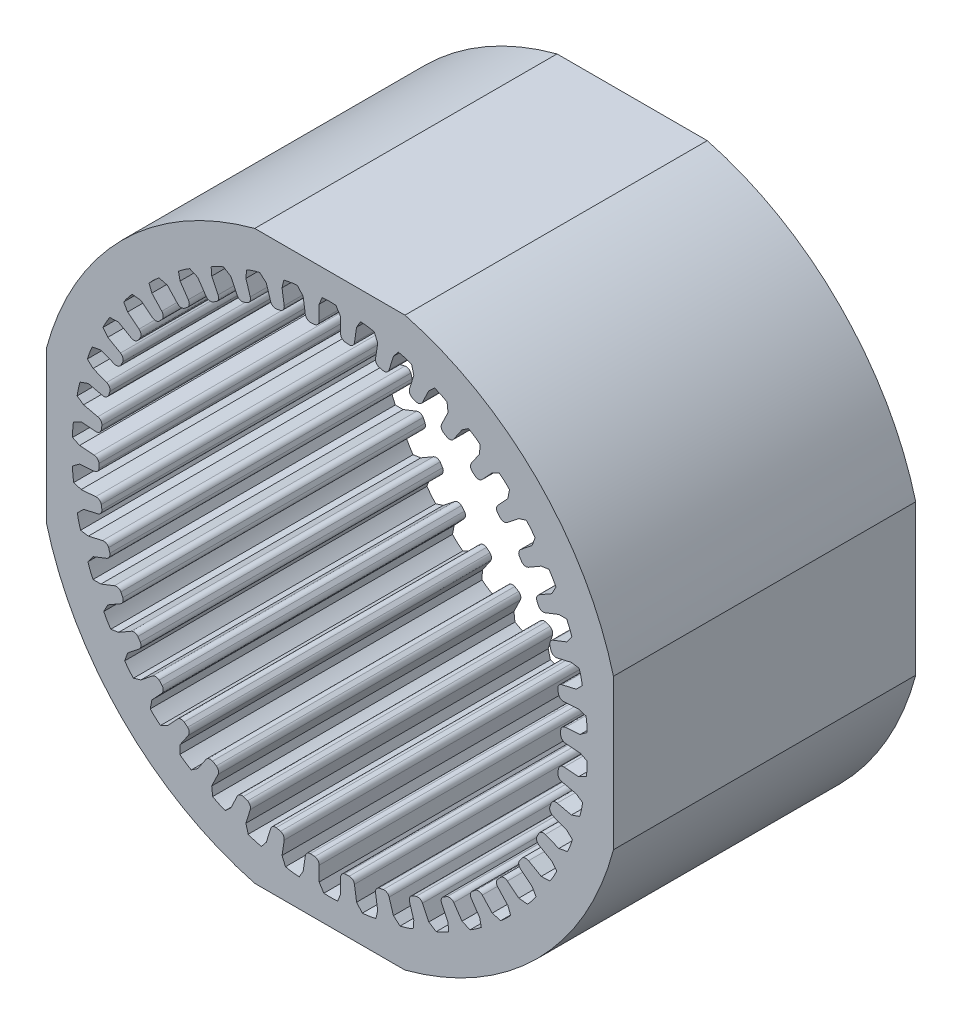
SolidWorks part; units mm, degrees
ref_plane "Plan de face" through (0, 0, 0) normal (0, 0, 1) x (1, 0, 0)
ref_plane "Plan de dessus" through (0, 0, 0) normal (0, 1, 0) x (1, 0, 0)
ref_plane "Plan de droite" through (0, 0, 0) normal (1, 0, 0) x (0, 0, -1)
sketch "Esquisse2" plane through (0, 0, 0) normal (0, 0, 1) x (1, 0, 0)
  line L0 (-28.1926, 15.95) -> (-15.95, 15.95)
  line L1 (-15.95, 18.2904) -> (-15.95, 15.95)
  line L2 (0, 0) -> (0, 12.7931) construction
  line L3 (0, 0) -> (11.1029, 0) construction
  line L5 (15.95, 4.2246) -> (15.95, -4.2246)
  line L6 (-4.2246, 15.95) -> (4.2246, 15.95)
  line L8 (-15.95, 4.2246) -> (-15.95, -4.2246)
  line L9 (-4.2246, -15.95) -> (4.2246, -15.95)
  arc A0 (-4.2246, 15.95) -> (-15.95, 4.2246) centre (0, 0) ccw
  arc A1 (-15.95, -4.2246) -> (-4.2246, -15.95) centre (0, 0) ccw
  arc A2 (4.2246, -15.95) -> (15.95, -4.2246) centre (0, 0) ccw
  arc A3 (15.95, 4.2246) -> (4.2246, 15.95) centre (0, 0) ccw
  dimension "D1" = 33
  dimension "D2" = 15.95
  dimension "D3" = 15.95
extrude "Extrusion1" add sketch "Esquisse2" along normal blind 17 contours L5 A3 L6 A0 L8 A1 L9 A2
sketch "Esquisse3" plane through (0, 0, 17) normal (0, 0, 1) x (1, 0, 0)
  line L0 (-0.4376, 14.4796) -> (-0.6, 14.071)
  line L1 (-0.6, 14.071) -> (-0.6, 13.25)
  line L2 (0.6, 14.0711) -> (0.6, 13.2527)
  line L3 (0.3385, 14.4878) -> (0.6, 14.0711)
  line L4 (0, 0) -> (0, 17.4119) construction
  line L5 (0, 14.5) -> (0, -4.5486) construction
  line L6 (1.7254, 14.3831) -> (1.5039, 14.0033)
  line L7 (1.5039, 14.0033) -> (1.3815, 13.1914)
  line L8 (2.6905, 13.8245) -> (2.5685, 13.0152)
  line L9 (2.494, 14.2755) -> (2.6905, 13.8245)
  line L10 (3.8498, 13.9653) -> (3.5742, 13.6228)
  line L11 (3.5742, 13.6228) -> (3.3322, 12.8382)
  line L12 (4.7209, 13.2691) -> (4.4796, 12.4871)
  line L13 (4.5938, 13.7444) -> (4.7209, 13.2691)
  line L14 (5.8882, 13.2355) -> (5.5646, 12.9379)
  line L15 (5.5646, 12.9379) -> (5.2084, 12.1982)
  line L16 (6.6458, 12.4173) -> (6.2907, 11.6799)
  line L17 (6.591, 12.9062) -> (6.6458, 12.4173)
  line L18 (7.7951, 12.2101) -> (7.4308, 11.964)
  line L19 (7.4308, 11.964) -> (6.9682, 11.2857)
  line L20 (8.4223, 11.2881) -> (7.9612, 10.6119)
  line L21 (8.4409, 11.7797) -> (8.4223, 11.2881)
  line L22 (9.5279, 10.9119) -> (9.1309, 10.7229)
  line L23 (9.1309, 10.7229) -> (8.5725, 10.121)
  line L24 (10.0106, 9.9067) -> (9.4539, 9.3068)
  line L25 (10.1023, 10.3901) -> (10.0106, 9.9067)
  line L26 (11.0478, 9.37) -> (10.6271, 9.2422)
  line L27 (10.6271, 9.2422) -> (9.9852, 8.7303)
  line L28 (11.3753, 8.3041) -> (10.7355, 7.7938)
  line L29 (11.538, 8.7684) -> (11.3753, 8.3041)
  line L30 (12.3209, 7.6187) -> (11.8859, 7.5551)
  line L31 (11.8859, 7.5551) -> (11.1748, 7.1446)
  line L32 (12.4859, 6.5159) -> (11.7772, 6.1067)
  line L33 (12.716, 6.9508) -> (12.4859, 6.5159)
  line L34 (13.3188, 5.6973) -> (12.8792, 5.6993)
  line L35 (12.8792, 5.6993) -> (12.1149, 5.3993)
  line L36 (13.3176, 4.5822) -> (12.5558, 4.2832)
  line L37 (13.61, 4.9779) -> (13.3176, 4.5822)
  line L38 (14.0192, 3.6486) -> (13.5847, 3.7161)
  line L39 (13.5847, 3.7161) -> (12.7843, 3.5334)
  line L40 (13.8518, 2.5461) -> (13.0539, 2.364)
  line L41 (14.1999, 2.8939) -> (13.8518, 2.5461)
  line L42 (14.4064, 1.5184) -> (13.9869, 1.6499)
  line L43 (13.9869, 1.6499) -> (13.1681, 1.5885)
  line L44 (14.0765, 0.4532) -> (13.2605, 0.3921)
  line L45 (14.4726, 0.7451) -> (14.0765, 0.4532)
  line L46 (14.4718, -0.6457) -> (14.0765, -0.4532)
  line L47 (14.0765, -0.4532) -> (13.2578, -0.3919)
  line L48 (13.9869, -1.6499) -> (13.1708, -1.5887)
  line L49 (14.422, -1.4202) -> (13.9869, -1.6499)
  line L50 (14.2139, -2.7954) -> (13.8518, -2.5461)
  line L51 (13.8518, -2.5461) -> (13.0513, -2.3634)
  line L52 (13.5848, -3.7161) -> (12.7869, -3.534)
  line L53 (14.0492, -3.5538) -> (13.5848, -3.7161)
  line L54 (13.6385, -4.8827) -> (13.3176, -4.5822)
  line L55 (13.3176, -4.5822) -> (12.5533, -4.2822)
  line L56 (12.8792, -5.6993) -> (12.1174, -5.4003)
  line L57 (13.3627, -5.6081) -> (12.8792, -5.6993)
  line L58 (12.7585, -6.8609) -> (12.4859, -6.5159)
  line L59 (12.4859, -6.5159) -> (11.7748, -6.1054)
  line L60 (11.8859, -7.5551) -> (11.1772, -7.146)
  line L61 (12.3776, -7.537) -> (11.8859, -7.5551)
  line L62 (11.5934, -8.6858) -> (11.3753, -8.3041)
  line L63 (11.3753, -8.3041) -> (10.7334, -7.7921)
  line L64 (10.6271, -9.2423) -> (9.9873, -8.732)
  line L65 (11.116, -9.2976) -> (10.6271, -9.2423)
  line L66 (10.1694, -10.3167) -> (10.0106, -9.9067)
  line L67 (10.0106, -9.9067) -> (9.4521, -9.3048)
  line L68 (9.1309, -10.7229) -> (8.5743, -10.123)
  line L69 (9.6061, -10.8505) -> (9.1309, -10.7229)
  line L70 (8.5182, -11.7171) -> (8.4222, -11.288)
  line L71 (8.4222, -11.288) -> (7.9597, -10.6097)
  line L72 (7.4308, -11.964) -> (6.9698, -11.2879)
  line L73 (7.8816, -12.161) -> (7.4308, -11.964)
  line L74 (6.6767, -12.8558) -> (6.6458, -12.4172)
  line L75 (6.6458, -12.4172) -> (6.2895, -11.6775)
  line L76 (5.5646, -12.9379) -> (5.2095, -12.2006)
  line L77 (5.9811, -13.1999) -> (5.5646, -12.9379)
  line L78 (4.6861, -13.7073) -> (4.7209, -13.2691)
  line L79 (4.7209, -13.2691) -> (4.4788, -12.4845)
  line L80 (3.5742, -13.6228) -> (3.333, -12.8408)
  line L81 (3.9469, -13.9439) -> (3.5742, -13.6228)
  line L82 (2.5907, -14.2526) -> (2.6905, -13.8245)
  line L83 (2.6905, -13.8245) -> (2.5681, -13.0126)
  line L84 (1.5039, -14.0033) -> (1.3819, -13.1941)
  line L85 (1.8246, -14.3764) -> (1.5039, -14.0033)
  line L86 (0.4376, -14.4796) -> (0.6, -14.071)
  line L87 (0.6, -14.071) -> (0.6, -13.25)
  line L88 (-0.6, -14.0711) -> (-0.6, -13.2527)
  line L89 (-0.3385, -14.4878) -> (-0.6, -14.0711)
  line L90 (-1.7254, -14.3831) -> (-1.5039, -14.0033)
  line L91 (-1.5039, -14.0033) -> (-1.3815, -13.1914)
  line L92 (-2.6905, -13.8245) -> (-2.5685, -13.0152)
  line L93 (-2.494, -14.2755) -> (-2.6905, -13.8245)
  line L94 (-3.8498, -13.9653) -> (-3.5742, -13.6228)
  line L95 (-3.5742, -13.6228) -> (-3.3322, -12.8382)
  line L96 (-4.7209, -13.2691) -> (-4.4796, -12.4871)
  line L97 (-4.5938, -13.7444) -> (-4.7209, -13.2691)
  line L98 (-5.8882, -13.2355) -> (-5.5646, -12.9379)
  line L99 (-5.5646, -12.9379) -> (-5.2084, -12.1982)
  line L100 (-6.6458, -12.4173) -> (-6.2907, -11.6799)
  line L101 (-6.591, -12.9062) -> (-6.6458, -12.4173)
  line L102 (-7.7951, -12.2101) -> (-7.4308, -11.964)
  line L103 (-7.4308, -11.964) -> (-6.9682, -11.2857)
  line L104 (-8.4223, -11.2881) -> (-7.9612, -10.6119)
  line L105 (-8.4409, -11.7797) -> (-8.4223, -11.2881)
  line L106 (-9.5279, -10.9119) -> (-9.1309, -10.7229)
  line L107 (-9.1309, -10.7229) -> (-8.5725, -10.121)
  line L108 (-10.0106, -9.9067) -> (-9.4539, -9.3068)
  line L109 (-10.1023, -10.3901) -> (-10.0106, -9.9067)
  line L110 (-11.0478, -9.37) -> (-10.6271, -9.2422)
  line L111 (-10.6271, -9.2422) -> (-9.9852, -8.7303)
  line L112 (-11.3753, -8.3041) -> (-10.7355, -7.7938)
  line L113 (-11.538, -8.7684) -> (-11.3753, -8.3041)
  line L114 (-12.3209, -7.6187) -> (-11.8859, -7.5551)
  line L115 (-11.8859, -7.5551) -> (-11.1748, -7.1446)
  line L116 (-12.4859, -6.5159) -> (-11.7772, -6.1067)
  line L117 (-12.716, -6.9508) -> (-12.4859, -6.5159)
  line L118 (-13.3188, -5.6973) -> (-12.8792, -5.6993)
  line L119 (-12.8792, -5.6993) -> (-12.1149, -5.3993)
  line L120 (-13.3176, -4.5822) -> (-12.5558, -4.2832)
  line L121 (-13.61, -4.9779) -> (-13.3176, -4.5822)
  line L122 (-14.0192, -3.6486) -> (-13.5847, -3.7161)
  line L123 (-13.5847, -3.7161) -> (-12.7843, -3.5334)
  line L124 (-13.8518, -2.5461) -> (-13.0539, -2.364)
  line L125 (-14.1999, -2.8939) -> (-13.8518, -2.5461)
  line L126 (-14.4064, -1.5184) -> (-13.9869, -1.6499)
  line L127 (-13.9869, -1.6499) -> (-13.1681, -1.5885)
  line L128 (-14.0765, -0.4532) -> (-13.2605, -0.3921)
  line L129 (-14.4726, -0.7451) -> (-14.0765, -0.4532)
  line L130 (-14.4718, 0.6457) -> (-14.0765, 0.4532)
  line L131 (-14.0765, 0.4532) -> (-13.2578, 0.3919)
  line L132 (-13.9869, 1.6499) -> (-13.1708, 1.5887)
  line L133 (-14.422, 1.4202) -> (-13.9869, 1.6499)
  line L134 (-14.2139, 2.7954) -> (-13.8518, 2.5461)
  line L135 (-13.8518, 2.5461) -> (-13.0513, 2.3634)
  line L136 (-13.5848, 3.7161) -> (-12.7869, 3.534)
  line L137 (-14.0492, 3.5538) -> (-13.5848, 3.7161)
  line L138 (-13.6385, 4.8827) -> (-13.3176, 4.5822)
  line L139 (-13.3176, 4.5822) -> (-12.5533, 4.2822)
  line L140 (-12.8792, 5.6993) -> (-12.1174, 5.4003)
  line L141 (-13.3627, 5.6081) -> (-12.8792, 5.6993)
  line L142 (-12.7585, 6.8609) -> (-12.4859, 6.5159)
  line L143 (-12.4859, 6.5159) -> (-11.7748, 6.1054)
  line L144 (-11.8859, 7.5551) -> (-11.1772, 7.146)
  line L145 (-12.3776, 7.537) -> (-11.8859, 7.5551)
  line L146 (-11.5934, 8.6858) -> (-11.3753, 8.3041)
  line L147 (-11.3753, 8.3041) -> (-10.7334, 7.7921)
  line L148 (-10.6271, 9.2423) -> (-9.9873, 8.732)
  line L149 (-11.116, 9.2976) -> (-10.6271, 9.2423)
  line L150 (-10.1694, 10.3167) -> (-10.0106, 9.9067)
  line L151 (-10.0106, 9.9067) -> (-9.4521, 9.3048)
  line L152 (-9.1309, 10.7229) -> (-8.5743, 10.123)
  line L153 (-9.6061, 10.8505) -> (-9.1309, 10.7229)
  line L154 (-8.5182, 11.7171) -> (-8.4222, 11.288)
  line L155 (-8.4222, 11.288) -> (-7.9597, 10.6097)
  line L156 (-7.4308, 11.964) -> (-6.9698, 11.2879)
  line L157 (-7.8816, 12.161) -> (-7.4308, 11.964)
  line L158 (-6.6767, 12.8558) -> (-6.6458, 12.4172)
  line L159 (-6.6458, 12.4172) -> (-6.2895, 11.6775)
  line L160 (-5.5646, 12.9379) -> (-5.2095, 12.2006)
  line L161 (-5.9811, 13.1999) -> (-5.5646, 12.9379)
  line L162 (-4.6861, 13.7073) -> (-4.7209, 13.2691)
  line L163 (-4.7209, 13.2691) -> (-4.4788, 12.4845)
  line L164 (-3.5742, 13.6228) -> (-3.333, 12.8408)
  line L165 (-3.9469, 13.9439) -> (-3.5742, 13.6228)
  line L166 (-2.5907, 14.2526) -> (-2.6905, 13.8245)
  line L167 (-2.6905, 13.8245) -> (-2.5681, 13.0126)
  line L168 (-1.5039, 14.0033) -> (-1.3819, 13.1941)
  line L169 (-1.8246, 14.3764) -> (-1.5039, 14.0033)
  line L170 (0.8462, 12.9578) -> (1.0982, 12.9364)
  line L171 (2.768, 12.6869) -> (3.014, 12.6283)
  line L172 (4.628, 12.1327) -> (4.8625, 12.038)
  line L173 (6.3846, 11.3074) -> (6.6023, 11.1789)
  line L174 (7.9985, 10.2295) -> (8.1947, 10.07)
  line L175 (9.4338, 8.9232) -> (9.604, 8.7361)
  line L176 (10.6584, 7.4175) -> (10.7988, 7.2072)
  line L177 (11.6448, 5.7461) -> (11.7524, 5.5172)
  line L178 (12.3712, 3.9463) -> (12.4434, 3.704)
  line L179 (12.8212, 2.0584) -> (12.8565, 1.808)
  line L180 (12.9848, 0.1245) -> (12.9823, -0.1284)
  line L181 (12.8583, -1.8122) -> (12.8182, -2.0618)
  line L182 (12.4446, -3.7083) -> (12.3677, -3.9493)
  line L183 (11.7529, -5.5217) -> (11.641, -5.7485)
  line L184 (10.7987, -7.2117) -> (10.6542, -7.4193)
  line L185 (9.6032, -8.7406) -> (9.4294, -8.9243)
  line L186 (8.1932, -10.0743) -> (7.994, -10.23)
  line L187 (6.6002, -11.1829) -> (6.38, -11.3072)
  line L188 (4.8598, -12.0417) -> (4.6235, -12.1318)
  line L189 (3.0108, -12.6315) -> (2.7637, -12.6854)
  line L190 (1.0945, -12.9391) -> (0.8422, -12.9556)
  line L191 (-0.8462, -12.9578) -> (-1.0982, -12.9364)
  line L192 (-2.768, -12.6869) -> (-3.014, -12.6283)
  line L193 (-4.628, -12.1327) -> (-4.8625, -12.038)
  line L194 (-6.3846, -11.3074) -> (-6.6023, -11.1789)
  line L195 (-7.9985, -10.2295) -> (-8.1947, -10.07)
  line L196 (-9.4338, -8.9232) -> (-9.604, -8.7361)
  line L197 (-10.6584, -7.4175) -> (-10.7988, -7.2072)
  line L198 (-11.6448, -5.7461) -> (-11.7524, -5.5172)
  line L199 (-12.3712, -3.9463) -> (-12.4434, -3.704)
  line L200 (-12.8212, -2.0584) -> (-12.8565, -1.808)
  line L201 (-12.9848, -0.1245) -> (-12.9823, 0.1284)
  line L202 (-12.8583, 1.8122) -> (-12.8182, 2.0618)
  line L203 (-12.4446, 3.7083) -> (-12.3677, 3.9493)
  line L204 (-11.7529, 5.5217) -> (-11.641, 5.7485)
  line L205 (-10.7987, 7.2117) -> (-10.6542, 7.4193)
  line L206 (-9.6032, 8.7406) -> (-9.4294, 8.9243)
  line L207 (-8.1932, 10.0743) -> (-7.994, 10.23)
  line L208 (-6.6002, 11.1829) -> (-6.38, 11.3072)
  line L209 (-4.8598, 12.0417) -> (-4.6235, 12.1318)
  line L210 (-3.0108, 12.6315) -> (-2.7637, 12.6854)
  line L211 (-1.0945, 12.9391) -> (-0.8422, 12.9556)
  arc A0 (1.3815, 13.1914) -> (1.0982, 12.9364) centre (1.0849, 13.2361) cw
  arc A1 (-0.6, 13.25) -> (-0.8422, 12.9556) centre (-0.9, 13.25) cw
  arc A2 (0.6, 13.2527) -> (0.8462, 12.9578) centre (0.9, 13.2529) ccw
  arc A3 (2.5685, 13.0152) -> (2.768, 12.6869) centre (2.8652, 12.9707) ccw
  arc A4 (2.494, 14.2755) -> (1.7254, 14.3831) centre (1.4606, 9.6905) ccw
  arc A5 (3.3322, 12.8382) -> (3.014, 12.6283) centre (3.0455, 12.9266) cw
  arc A6 (0.3385, 14.4878) -> (-0.4376, 14.4796) centre (0, 9.8) ccw
  arc A7 (4.4796, 12.4871) -> (4.628, 12.1327) centre (4.7664, 12.3988) ccw
  arc A8 (4.5938, 13.7444) -> (3.8498, 13.9653) centre (2.8886, 9.3646) ccw
  arc A9 (5.2084, 12.1982) -> (4.8625, 12.038) centre (4.9381, 12.3283) cw
  arc A10 (6.2907, 11.6799) -> (6.3846, 11.3074) centre (6.5611, 11.5499) ccw
  arc A11 (6.591, 12.9062) -> (5.8882, 13.2355) centre (4.2521, 8.8295) ccw
  arc A12 (6.9682, 11.2857) -> (6.6023, 11.1789) centre (6.7204, 11.4547) cw
  arc A13 (7.9612, 10.6119) -> (7.9985, 10.2295) centre (8.2092, 10.4431) ccw
  arc A14 (8.4409, 11.7797) -> (7.7951, 12.2101) centre (5.5205, 8.0971) ccw
  arc A15 (8.5725, 10.121) -> (8.1947, 10.07) centre (8.3525, 10.3251) cw
  arc A16 (9.4539, 9.3068) -> (9.4338, 8.9232) centre (9.674, 9.1029) ccw
  arc A17 (10.1023, 10.3901) -> (9.5279, 10.9119) centre (6.6657, 7.1839) ccw
  arc A18 (9.9852, 8.7303) -> (9.604, 8.7361) centre (9.7981, 8.9649) cw
  arc A19 (10.7355, 7.7938) -> (10.6584, 7.4175) centre (10.9227, 7.5594) ccw
  arc A20 (11.538, 8.7684) -> (11.0478, 9.37) centre (7.6619, 6.1102) ccw
  arc A21 (11.1748, 7.1446) -> (10.7988, 7.2072) centre (11.0248, 7.4044) cw
  arc A22 (11.7772, 6.1067) -> (11.6448, 5.7461) centre (11.9273, 5.847) ccw
  arc A23 (12.716, 6.9508) -> (12.3209, 7.6187) centre (8.487, 4.9) ccw
  arc A24 (12.1149, 5.3993) -> (11.7524, 5.5172) centre (12.0053, 5.6786) cw
  arc A25 (12.5558, 4.2832) -> (12.3712, 3.9463) centre (12.6656, 4.004) ccw
  arc A26 (13.61, 4.9779) -> (13.3188, 5.6973) centre (9.1226, 3.5803) ccw
  arc A27 (12.7843, 3.5334) -> (12.4434, 3.704) centre (12.7175, 3.8258) cw
  arc A28 (13.0539, 2.364) -> (12.8212, 2.0584) centre (13.1209, 2.0716) ccw
  arc A29 (14.1999, 2.8939) -> (14.0192, 3.6486) centre (9.5543, 2.1807) ccw
  arc A30 (13.1681, 1.5885) -> (12.8565, 1.808) centre (13.1457, 1.8877) cw
  arc A31 (13.2605, 0.3921) -> (12.9848, 0.1245) centre (13.2831, 0.0929) ccw
  arc A32 (14.4726, 0.7451) -> (14.4064, 1.5184) centre (9.7726, 0.7324) ccw
  arc A33 (13.2578, -0.3919) -> (12.9823, -0.1284) centre (13.2802, -0.0927) cw
  arc A34 (13.1708, -1.5887) -> (12.8583, -1.8122) centre (13.1486, -1.8879) ccw
  arc A35 (14.422, -1.4202) -> (14.4718, -0.6457) centre (9.7726, -0.7324) ccw
  arc A36 (13.0513, -2.3634) -> (12.8182, -2.0618) centre (13.1181, -2.071) cw
  arc A37 (12.7869, -3.534) -> (12.4446, -3.7083) centre (12.7203, -3.8265) ccw
  arc A38 (14.0492, -3.5538) -> (14.2139, -2.7954) centre (9.5543, -2.1807) ccw
  arc A39 (12.5533, -4.2822) -> (12.3677, -3.9493) centre (12.6629, -4.003) cw
  arc A40 (12.1174, -5.4003) -> (11.7529, -5.5217) centre (12.008, -5.6796) ccw
  arc A41 (13.3627, -5.6081) -> (13.6385, -4.8827) centre (9.1226, -3.5803) ccw
  arc A42 (11.7748, -6.1054) -> (11.641, -5.7485) centre (11.9248, -5.8456) cw
  arc A43 (11.1772, -7.146) -> (10.7987, -7.2117) centre (11.0273, -7.4059) ccw
  arc A44 (12.3776, -7.537) -> (12.7585, -6.8609) centre (8.487, -4.9) ccw
  arc A45 (10.7334, -7.7921) -> (10.6542, -7.4193) centre (10.9204, -7.5576) cw
  arc A46 (9.9873, -8.732) -> (9.6032, -8.7406) centre (9.8004, -8.9667) ccw
  arc A47 (11.116, -9.2976) -> (11.5934, -8.6858) centre (7.6619, -6.1102) ccw
  arc A48 (9.4521, -9.3048) -> (9.4294, -8.9243) centre (9.672, -9.1008) cw
  arc A49 (8.5743, -10.123) -> (8.1932, -10.0743) centre (8.3545, -10.3272) ccw
  arc A50 (9.6061, -10.8505) -> (10.1694, -10.3167) centre (6.6657, -7.1839) ccw
  arc A51 (7.9597, -10.6097) -> (7.994, -10.23) centre (8.2076, -10.4407) cw
  arc A52 (6.9698, -11.2879) -> (6.6002, -11.1829) centre (6.722, -11.457) ccw
  arc A53 (7.8816, -12.161) -> (8.5182, -11.7171) centre (5.5205, -8.0971) ccw
  arc A54 (6.2895, -11.6775) -> (6.38, -11.3072) centre (6.5598, -11.5473) cw
  arc A55 (5.2095, -12.2006) -> (4.8598, -12.0417) centre (4.9393, -12.3309) ccw
  arc A56 (5.9811, -13.1999) -> (6.6767, -12.8558) centre (4.2521, -8.8295) ccw
  arc A57 (4.4788, -12.4845) -> (4.6235, -12.1318) centre (4.7655, -12.3961) cw
  arc A58 (3.333, -12.8408) -> (3.0108, -12.6315) centre (3.0463, -12.9294) ccw
  arc A59 (3.9469, -13.9439) -> (4.6861, -13.7073) centre (2.8886, -9.3646) ccw
  arc A60 (2.5681, -13.0126) -> (2.7637, -12.6854) centre (2.8648, -12.9679) cw
  arc A61 (1.3819, -13.1941) -> (1.0945, -12.9391) centre (1.0853, -13.239) ccw
  arc A62 (1.8246, -14.3764) -> (2.5907, -14.2526) centre (1.4606, -9.6905) ccw
  arc A63 (0.6, -13.25) -> (0.8422, -12.9556) centre (0.9, -13.25) cw
  arc A64 (-0.6, -13.2527) -> (-0.8462, -12.9578) centre (-0.9, -13.2529) ccw
  arc A65 (-0.3385, -14.4878) -> (0.4376, -14.4796) centre (0, -9.8) ccw
  arc A66 (-1.3815, -13.1914) -> (-1.0982, -12.9364) centre (-1.0849, -13.2361) cw
  arc A67 (-2.5685, -13.0152) -> (-2.768, -12.6869) centre (-2.8652, -12.9707) ccw
  arc A68 (-2.494, -14.2755) -> (-1.7254, -14.3831) centre (-1.4606, -9.6905) ccw
  arc A69 (-3.3322, -12.8382) -> (-3.014, -12.6283) centre (-3.0455, -12.9266) cw
  arc A70 (-4.4796, -12.4871) -> (-4.628, -12.1327) centre (-4.7664, -12.3988) ccw
  arc A71 (-4.5938, -13.7444) -> (-3.8498, -13.9653) centre (-2.8886, -9.3646) ccw
  arc A72 (-5.2084, -12.1982) -> (-4.8625, -12.038) centre (-4.9381, -12.3283) cw
  arc A73 (-6.2907, -11.6799) -> (-6.3846, -11.3074) centre (-6.5611, -11.5499) ccw
  arc A74 (-6.591, -12.9062) -> (-5.8882, -13.2355) centre (-4.2521, -8.8295) ccw
  arc A75 (-6.9682, -11.2857) -> (-6.6023, -11.1789) centre (-6.7204, -11.4547) cw
  arc A76 (-7.9612, -10.6119) -> (-7.9985, -10.2295) centre (-8.2092, -10.4431) ccw
  arc A77 (-8.4409, -11.7797) -> (-7.7951, -12.2101) centre (-5.5205, -8.0971) ccw
  arc A78 (-8.5725, -10.121) -> (-8.1947, -10.07) centre (-8.3525, -10.3251) cw
  arc A79 (-9.4539, -9.3068) -> (-9.4338, -8.9232) centre (-9.674, -9.1029) ccw
  arc A80 (-10.1023, -10.3901) -> (-9.5279, -10.9119) centre (-6.6657, -7.1839) ccw
  arc A81 (-9.9852, -8.7303) -> (-9.604, -8.7361) centre (-9.7981, -8.9649) cw
  arc A82 (-10.7355, -7.7938) -> (-10.6584, -7.4175) centre (-10.9227, -7.5594) ccw
  arc A83 (-11.538, -8.7684) -> (-11.0478, -9.37) centre (-7.6619, -6.1102) ccw
  arc A84 (-11.1748, -7.1446) -> (-10.7988, -7.2072) centre (-11.0248, -7.4044) cw
  arc A85 (-11.7772, -6.1067) -> (-11.6448, -5.7461) centre (-11.9273, -5.847) ccw
  arc A86 (-12.716, -6.9508) -> (-12.3209, -7.6187) centre (-8.487, -4.9) ccw
  arc A87 (-12.1149, -5.3993) -> (-11.7524, -5.5172) centre (-12.0053, -5.6786) cw
  arc A88 (-12.5558, -4.2832) -> (-12.3712, -3.9463) centre (-12.6656, -4.004) ccw
  arc A89 (-13.61, -4.9779) -> (-13.3188, -5.6973) centre (-9.1226, -3.5803) ccw
  arc A90 (-12.7843, -3.5334) -> (-12.4434, -3.704) centre (-12.7175, -3.8258) cw
  arc A91 (-13.0539, -2.364) -> (-12.8212, -2.0584) centre (-13.1209, -2.0716) ccw
  arc A92 (-14.1999, -2.8939) -> (-14.0192, -3.6486) centre (-9.5543, -2.1807) ccw
  arc A93 (-13.1681, -1.5885) -> (-12.8565, -1.808) centre (-13.1457, -1.8877) cw
  arc A94 (-13.2605, -0.3921) -> (-12.9848, -0.1245) centre (-13.2831, -0.0929) ccw
  arc A95 (-14.4726, -0.7451) -> (-14.4064, -1.5184) centre (-9.7726, -0.7324) ccw
  arc A96 (-13.2578, 0.3919) -> (-12.9823, 0.1284) centre (-13.2802, 0.0927) cw
  arc A97 (-13.1708, 1.5887) -> (-12.8583, 1.8122) centre (-13.1486, 1.8879) ccw
  arc A98 (-14.422, 1.4202) -> (-14.4718, 0.6457) centre (-9.7726, 0.7324) ccw
  arc A99 (-13.0513, 2.3634) -> (-12.8182, 2.0618) centre (-13.1181, 2.071) cw
  arc A100 (-12.7869, 3.534) -> (-12.4446, 3.7083) centre (-12.7203, 3.8265) ccw
  arc A101 (-14.0492, 3.5538) -> (-14.2139, 2.7954) centre (-9.5543, 2.1807) ccw
  arc A102 (-12.5533, 4.2822) -> (-12.3677, 3.9493) centre (-12.6629, 4.003) cw
  arc A103 (-12.1174, 5.4003) -> (-11.7529, 5.5217) centre (-12.008, 5.6796) ccw
  arc A104 (-13.3627, 5.6081) -> (-13.6385, 4.8827) centre (-9.1226, 3.5803) ccw
  arc A105 (-11.7748, 6.1054) -> (-11.641, 5.7485) centre (-11.9248, 5.8456) cw
  arc A106 (-11.1772, 7.146) -> (-10.7987, 7.2117) centre (-11.0273, 7.4059) ccw
  arc A107 (-12.3776, 7.537) -> (-12.7585, 6.8609) centre (-8.487, 4.9) ccw
  arc A108 (-10.7334, 7.7921) -> (-10.6542, 7.4193) centre (-10.9204, 7.5576) cw
  arc A109 (-9.9873, 8.732) -> (-9.6032, 8.7406) centre (-9.8004, 8.9667) ccw
  arc A110 (-11.116, 9.2976) -> (-11.5934, 8.6858) centre (-7.6619, 6.1102) ccw
  arc A111 (-9.4521, 9.3048) -> (-9.4294, 8.9243) centre (-9.672, 9.1008) cw
  arc A112 (-8.5743, 10.123) -> (-8.1932, 10.0743) centre (-8.3545, 10.3272) ccw
  arc A113 (-9.6061, 10.8505) -> (-10.1694, 10.3167) centre (-6.6657, 7.1839) ccw
  arc A114 (-7.9597, 10.6097) -> (-7.994, 10.23) centre (-8.2076, 10.4407) cw
  arc A115 (-6.9698, 11.2879) -> (-6.6002, 11.1829) centre (-6.722, 11.457) ccw
  arc A116 (-7.8816, 12.161) -> (-8.5182, 11.7171) centre (-5.5205, 8.0971) ccw
  arc A117 (-6.2895, 11.6775) -> (-6.38, 11.3072) centre (-6.5598, 11.5473) cw
  arc A118 (-5.2095, 12.2006) -> (-4.8598, 12.0417) centre (-4.9393, 12.3309) ccw
  arc A119 (-5.9811, 13.1999) -> (-6.6767, 12.8558) centre (-4.2521, 8.8295) ccw
  arc A120 (-4.4788, 12.4845) -> (-4.6235, 12.1318) centre (-4.7655, 12.3961) cw
  arc A121 (-3.333, 12.8408) -> (-3.0108, 12.6315) centre (-3.0463, 12.9294) ccw
  arc A122 (-3.9469, 13.9439) -> (-4.6861, 13.7073) centre (-2.8886, 9.3646) ccw
  arc A123 (-2.5681, 13.0126) -> (-2.7637, 12.6854) centre (-2.8648, 12.9679) cw
  arc A124 (-1.3819, 13.1941) -> (-1.0945, 12.9391) centre (-1.0853, 13.239) ccw
  arc A125 (-1.8246, 14.3764) -> (-2.5907, 14.2526) centre (-1.4606, 9.6905) ccw
  dimension "D1" = 0.3
  dimension "D6" = 0.3
  dimension "D2" = 14.5
  dimension "D3" = 0.6
  dimension "D4" = 0.6
  dimension "D5" = 4.7
  dimension "D7" = 0.8184
  dimension "D8" = 0.492
  dimension "D9" = 4.2711
  dimension "D10" = 4.271
  dimension "D11" = 0.4397
  dimension "D12" = 0.821
extrude "Enlèv. mat.-Extru.2" cut sketch "Esquisse3" against normal through all
